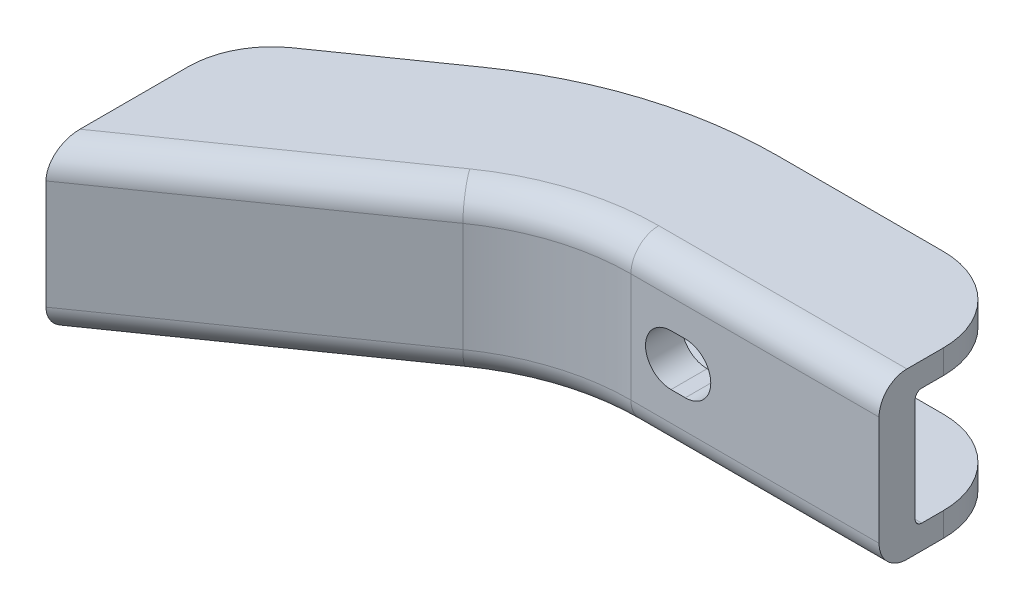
SolidWorks part; units mm, degrees
ref_plane "front" through (0, 0, 0) normal (0, 0, 1) x (1, 0, 0)
ref_plane "top" through (0, 0, 0) normal (0, 1, 0) x (1, 0, 0)
ref_plane "side" through (0, 0, 0) normal (1, 0, 0) x (0, 0, -1)
sketch "Sketch1" plane through (0, 0, 0) normal (0, 1, 0) x (1, 0, 0)
  line L0 (0, 0) -> (-28.3134, 0)
  line L1 (-50, 0) -> (50, 0) construction
  line L2 (-42.8823, -4.5935) -> (-70.8607, -24.1843)
  line L3 (-70.8607, -24.1843) -> (-70.8607, -7.9644)
  line L4 (-66.799, -0.162) -> (-53.9615, 8.8269)
  line L5 (-28.4661, 16.8656) -> (-9.525, 16.8656)
  line L6 (0, -50) -> (0, 50) construction
  line L7 (0, 7.3406) -> (0, 0)
  arc A0 (-28.3134, 0) -> (-42.8823, -4.5935) centre (-28.3134, -25.4) ccw
  arc A1 (-53.9615, 8.8269) -> (-28.4661, 16.8656) centre (-28.4661, -27.5844) cw
  arc A2 (-70.8607, -7.9644) -> (-66.799, -0.162) centre (-61.3357, -7.9644) cw
  arc A3 (-9.525, 16.8656) -> (0, 7.3406) centre (-9.525, 7.3406) cw
  point P13 (-36.322, 0)
  point P16 (0, 0)
  point P17 (-30.1732, -21.014)
  point P18 (-29.7058, -24.1843)
  point P19 (0, 0)
  point P24 (0, 16.8656)
  dimension "D6" = 25.4
  dimension "D7" = 44.45
  dimension "D8" = 9.525
  dimension "D1" = 16.8656
  dimension "D2" = 17.3482
  dimension "D3" = 35
  dimension "D4" = 36.322
  dimension "D5" = 42.164
extrude "Boss-Extrude1" add sketch "Sketch1" along normal blind 2.7432
sketch "Sketch2" plane through (0, 2.7432, 0) normal (0, 1, 0) x (1, 0, 0)
  line L0 (0, 0) -> (0, 7.3406) construction
  line L1 (-70.8607, -7.9644) -> (-70.8607, -24.1843) construction
  line L2 (-70.8607, -24.1843) -> (-42.8823, -4.5935) construction
  line L3 (-28.3134, 0) -> (0, 0) construction
  line L4 (0, 0) -> (0, 4.1148)
  line L5 (-70.8607, -19.161) -> (-70.8607, -24.1843)
  line L6 (-70.8607, -24.1843) -> (-42.8823, -4.5935)
  line L7 (-28.3134, 0) -> (0, 0)
  line L8 (-70.8607, -19.161) -> (-45.2424, -1.2229)
  line L9 (-28.3134, 4.1148) -> (0, 4.1148)
  line L10 (-73.2209, -20.8136) -> (-45.2424, -1.2229) construction
  arc A0 (-28.3134, 0) -> (-42.8823, -4.5935) centre (-28.3134, -25.4) ccw construction
  arc A1 (-28.3134, 0) -> (-42.8823, -4.5935) centre (-28.3134, -25.4) ccw
  arc A2 (-28.3134, 4.1148) -> (-45.2424, -1.2229) centre (-28.3134, -25.4) ccw
  dimension "D1" = 4.1148
extrude "Boss-Extrude2" add sketch "Sketch2" along normal blind 13.335
sketch "Sketch3" plane through (0, 16.0782, 0) normal (0, 1, 0) x (1, 0, 0)
  line L6 (-70.8607, -7.9644) -> (-70.8607, -24.1843)
  line L7 (-70.8607, -24.1843) -> (-42.8823, -4.5935)
  line L8 (-28.3134, 0) -> (0, 0)
  line L9 (0, 0) -> (0, 7.3406)
  line L10 (-9.525, 16.8656) -> (-28.4661, 16.8656)
  line L11 (-53.9615, 8.8269) -> (-66.799, -0.162)
  line L12 (-70.8607, -7.9644) -> (-70.8607, -24.1843)
  line L13 (-70.8607, -24.1843) -> (-42.8823, -4.5935)
  line L14 (-28.3134, 0) -> (0, 0)
  line L15 (0, 0) -> (0, 7.3406)
  line L16 (-9.525, 16.8656) -> (-28.4661, 16.8656)
  line L17 (-53.9615, 8.8269) -> (-66.799, -0.162)
  arc A4 (-28.3134, 0) -> (-42.8823, -4.5935) centre (-28.3134, -25.4) ccw
  arc A5 (0, 7.3406) -> (-9.525, 16.8656) centre (-9.525, 7.3406) ccw
  arc A6 (-28.4661, 16.8656) -> (-53.9615, 8.8269) centre (-28.4661, -27.5844) ccw
  arc A7 (-66.799, -0.162) -> (-70.8607, -7.9644) centre (-61.3357, -7.9644) ccw
  arc A8 (-28.3134, 0) -> (-42.8823, -4.5935) centre (-28.3134, -25.4) ccw
  arc A9 (0, 7.3406) -> (-9.525, 16.8656) centre (-9.525, 7.3406) ccw
  arc A10 (-28.4661, 16.8656) -> (-53.9615, 8.8269) centre (-28.4661, -27.5844) ccw
  arc A11 (-66.799, -0.162) -> (-70.8607, -7.9644) centre (-61.3357, -7.9644) ccw
  dimension "D1" = 0
extrude "Boss-Extrude3" add sketch "Sketch3" along normal blind 2.7432
fillet "Fillet1" radius 0.762 6 edges at (-58.0516, 2.7432, 10.192) (-37.1887, 2.7432, -2.7488) (-58.0516, 16.0782, 10.192) (-37.1887, 16.0782, -2.7488) (-14.1567, 2.7432, -4.1148) (-14.1567, 16.0782, -4.1148)
fillet "Fillet2" radius 3.175 6 edges at (-14.1567, 0, 0) (-35.9513, 0, 1.1756) (-56.8715, 18.8214, 14.3889) (-35.9513, 18.8214, 1.1756) (-56.8715, 0, 14.3889) (-14.1567, 18.8214, 0)
sketch "Sketch4" plane through (0, 0, -4.1148) normal (0, 0, -1) x (-1, 0, 0)
  line L0 (22.1107, 9.4107) -> (23.7363, 9.4107) construction
  line L1 (22.1107, 12.319) -> (23.7363, 12.319)
  line L2 (22.1107, 6.5024) -> (23.7363, 6.5024)
  line L3 (0, 9.4107) -> (36.6342, 9.4107) construction
  line L4 (0, 15.3162) -> (0, 3.5052) construction
  arc A0 (22.1107, 12.319) -> (22.1107, 6.5024) centre (22.1107, 9.4107) ccw
  arc A1 (23.7363, 6.5024) -> (23.7363, 12.319) centre (23.7363, 9.4107) ccw
  point P2 (22.9235, 9.4107)
  point P11 (0, 0)
  dimension "D2" = 7.4422
  dimension "D3" = 19.2024
  dimension "D1" = 5.8166
extrude "Cut-Extrude1" cut sketch "Sketch4" against normal blind 12.9032
